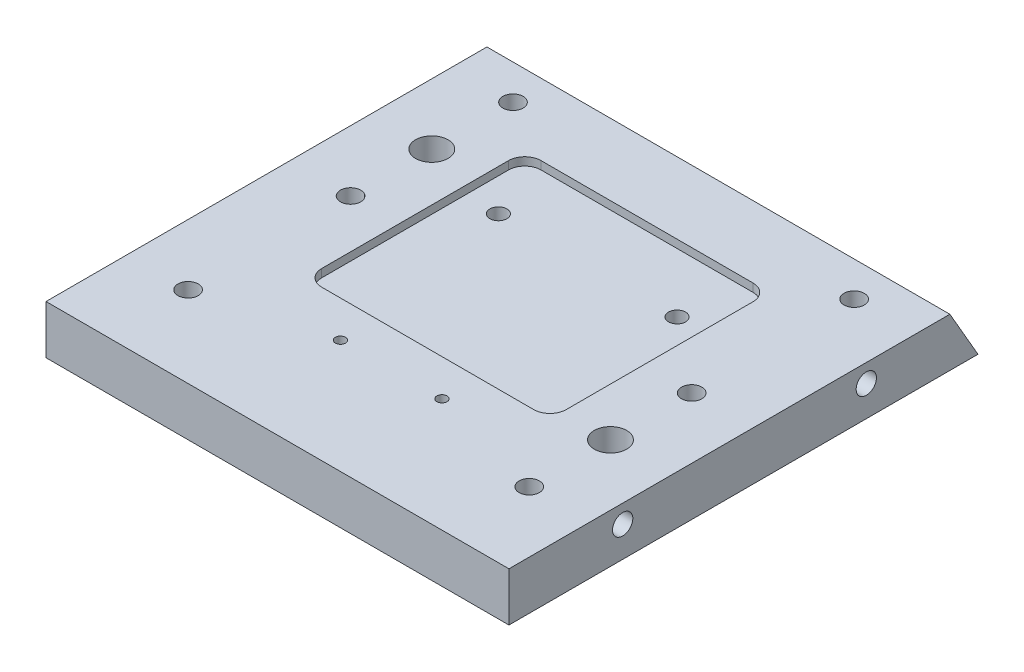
SolidWorks part; units mm, degrees
ref_plane "Front Plane" through (0, 0, 0) normal (0, 0, 1) x (1, 0, 0)
ref_plane "Top Plane" through (0, 0, 0) normal (0, 1, 0) x (1, 0, 0)
ref_plane "Right Plane" through (0, 0, 0) normal (1, 0, 0) x (0, 0, -1)
sketch "Sketch1" plane through (0, 0, 0) normal (1, 0, 0) x (0, 0, -1)
  line L0 (0, 0) -> (115.5, 0)
  line L1 (108.5718, 12) -> (115.5, 0)
  line L2 (108.5718, 12) -> (0, 12)
  line L3 (0, 12) -> (0, 0)
  dimension "D1" = 115.5
  dimension "D2" = 12
  dimension "D3" = 60
extrude "Boss-Extrude1" add sketch "Sketch1" along normal mid plane 114
hole_wizard "M6x1.0 Tapped Hole1" positions "Sketch9" profile "Sketch8" tap size "M6x1.0" standard "ANSI Metric"
sketch "Sketch9" plane through (0, 0, 0) normal (0, -1, 0) x (-1, 0, 0)
  line L0 (57, 0) -> (57, 115.5) construction
  line L1 (-57, 0) -> (57, 0) construction
  line L2 (-57, 0) -> (-57, 115.5) construction
  point P0 (42, 20)
  point P2 (42, 60)
  point P4 (42, 100)
  point P6 (-42, 100)
  point P8 (-42, 60)
  point P10 (-42, 20)
  dimension "D1" = 15
  dimension "D2" = 20
  dimension "D3" = 15
  dimension "D4" = 15
  dimension "D5" = 20
  dimension "D6" = 15
  dimension "D7" = 15
  dimension "D8" = 15
  dimension "D9" = 60
  dimension "D10" = 100
  dimension "D11" = 60
  dimension "D12" = 100
sketch "Sketch8" plane through (-42, 0, -20) normal (1, 0, 0) x (0, 0, -1)
  line L0 (0, 0) -> (0, 12)
  line L1 (0, 12) -> (2.5, 12)
  line L2 (2.5, 12) -> (2.5, 0)
  line L5 (2.5, 0) -> (0, 0)
  line L11 (0, -6.35) -> (0, 107.95) construction
  dimension "Thru Tap Drill Dia." = 5
  dimension "Thru Tap Drill Depth" = 12
hole_wizard "M6x1.0 Tapped Hole2" positions "Sketch15" profile "Sketch14" tap size "M6x1.0" standard "ANSI Metric"
sketch "Sketch15" plane through (57, 0, 0) normal (1, 0, 0) x (0, 0, -1)
  point P0 (88, 7.5)
  point P3 (28, 7.5)
sketch "Sketch14" plane through (57, 7.5, -88) normal (0, 1, 0) x (0, 0, -1)
  line L0 (0, 0) -> (0, 16.5022)
  line L1 (0, 16.5022) -> (2.5, 15)
  line L2 (2.5, 15) -> (2.5, 0)
  line L5 (2.5, 0) -> (0, 0)
  line L10 (0, 16.5022) -> (-2.5, 15) construction
  line L11 (0, -6.35) -> (0, 107.95) construction
  dimension "Tap Drill Dia." = 5
  dimension "Tap Drill Depth" = 15
  dimension "Drill Angle" = 118
hole_wizard "M6x1.0 Tapped Hole3" positions "Sketch17" profile "Sketch16" tap size "M6x1.0" standard "ANSI Metric"
sketch "Sketch17" plane through (-57, 0, 0) normal (-1, 0, 0) x (0, 0, 1)
  point P0 (-88, 7.5)
  point P3 (-28, 7.5)
sketch "Sketch16" plane through (-57, 7.5, -88) normal (0, 1, 0) x (0, 0, 1)
  line L0 (0, 0) -> (0, 16.5022)
  line L1 (0, 16.5022) -> (2.5, 15)
  line L2 (2.5, 15) -> (2.5, 0)
  line L5 (2.5, 0) -> (0, 0)
  line L10 (0, 16.5022) -> (-2.5, 15) construction
  line L11 (0, -6.35) -> (0, 107.95) construction
  dimension "Tap Drill Dia." = 5
  dimension "Tap Drill Depth" = 15
  dimension "Drill Angle" = 118
hole_wizard "M5x0.8 Tapped Hole1" positions "Sketch19" profile "Sketch18" tap size "M5x0.8" standard "ANSI Metric"
sketch "Sketch19" plane through (0, 12, 0) normal (0, 1, 0) x (1, 0, 0)
  line L0 (-22, 76.4) -> (22, 76.4) construction
  line L2 (57, 108.5718) -> (57, 0) construction
  line L3 (57, 0) -> (-57, 0) construction
  point P0 (-22, 76.4)
  point P2 (22, 76.4)
  dimension "D1" = 44
  dimension "D2" = 35
  dimension "D3" = 76.4
sketch "Sketch18" plane through (-22, 12, -76.4) normal (1, 0, 0) x (0, 0, 1)
  line L0 (0, 0) -> (0, 12)
  line L1 (0, 12) -> (2.1, 12)
  line L2 (2.1, 12) -> (2.1, 0)
  line L5 (2.1, 0) -> (0, 0)
  line L11 (0, -6.35) -> (0, 107.95) construction
  dimension "Thru Tap Drill Dia." = 4.2
  dimension "Thru Tap Drill Depth" = 12
sketch "Sketch20" plane through (0, 12, 0) normal (0, 1, 0) x (1, 0, 0)
  line L1 (-30.1, 37) -> (30.1, 37)
  line L2 (-30.1, 37) -> (-30.1, 91)
  line L3 (-30.1, 91) -> (30.1, 91)
  line L4 (30.1, 37) -> (30.1, 91)
  line L5 (-30.1, 91) -> (-57, 91) construction
  line L6 (-57, 108.5718) -> (-57, 0) construction
  line L7 (30.1, 91) -> (57, 91) construction
  line L8 (57, 108.5718) -> (57, 0) construction
  line L9 (57, 0) -> (-57, 0) construction
  dimension "D1" = 60.2
  dimension "D2" = 54
  dimension "D3" = 37
extrude "Cut-Extrude1" cut sketch "Sketch20" against normal blind 2
hole_wizard "Ø8.0 (8) Diameter Hole1" positions "Sketch22" profile "Sketch21" hole size "Ø8.0" standard "ANSI Metric"
sketch "Sketch22" plane through (0, 0, 0) normal (0, -1, 0) x (-1, 0, 0)
  point P0 (42, 80)
  point P3 (-42, 40)
sketch "Sketch21" plane through (-42, 0, -80) normal (1, 0, 0) x (0, 0, -1)
  line L0 (0, 0) -> (0, 12)
  line L1 (0, 12) -> (4, 12)
  line L2 (4, 12) -> (4, 0)
  line L5 (4, 0) -> (0, 0)
  line L11 (0, -6.35) -> (0, 107.95) construction
  dimension "Thru Hole Dia." = 8
  dimension "Thru Hole Depth" = 12
fillet "Fillet1" radius 4 4 edges at (30.1, 11, -91) (-30.1, 11, -91) (-30.1, 11, -37) (30.1, 11, -37)
hole_wizard "M3x0.5 Tapped Hole1" positions "Sketch24" profile "Sketch23" tap size "M3x0.5" standard "ANSI Metric"
sketch "Sketch24" plane through (0, 50.013, -86.625) normal (0, 0.5, -0.866) x (-1, 0, 0)
  line L0 (-47, -51.75) -> (47, -51.75) construction
  line L1 (47, -51.75) -> (57, -51.75) construction
  line L2 (57, -57.75) -> (57, -43.8936) construction
  line L4 (-47, -51.75) -> (-57, -51.75) construction
  line L5 (-57, -57.75) -> (-57, -43.8936) construction
  line L7 (-57, -57.75) -> (57, -57.75) construction
  point P0 (-47, -51.75)
  point P2 (47, -51.75)
  dimension "D1" = 10
  dimension "D2" = 6
sketch "Sketch23" plane through (47, 5.1962, -112.5) normal (1, 0, 0) x (0, 0.866, 0.5)
  line L0 (0, 0) -> (0, 8.2511)
  line L1 (0, 8.2511) -> (1.25, 7.5)
  line L2 (1.25, 7.5) -> (1.25, 0)
  line L5 (1.25, 0) -> (0, 0)
  line L10 (0, 8.2511) -> (-1.25, 7.5) construction
  line L11 (0, -6.35) -> (0, 107.95) construction
  dimension "Tap Drill Dia." = 2.5
  dimension "Tap Drill Depth" = 7.5
  dimension "Drill Angle" = 118
hole_wizard "M3x0.5 Tapped Hole2" positions "Sketch26" profile "Sketch25" tap size "M3x0.5" standard "ANSI Metric"
sketch "Sketch26" plane through (0, 0, 0) normal (0, -1, 0) x (-1, 0, 0)
  point P0 (-12.5, 28)
  point P3 (12.5, 28)
sketch "Sketch25" plane through (12.5, 0, -28) normal (1, 0, 0) x (0, 0, -1)
  line L0 (0, 0) -> (0, 12)
  line L1 (0, 12) -> (1.25, 12)
  line L2 (1.25, 12) -> (1.25, 0)
  line L5 (1.25, 0) -> (0, 0)
  line L11 (0, -6.35) -> (0, 107.95) construction
  dimension "Thru Tap Drill Dia." = 2.5
  dimension "Thru Tap Drill Depth" = 12
